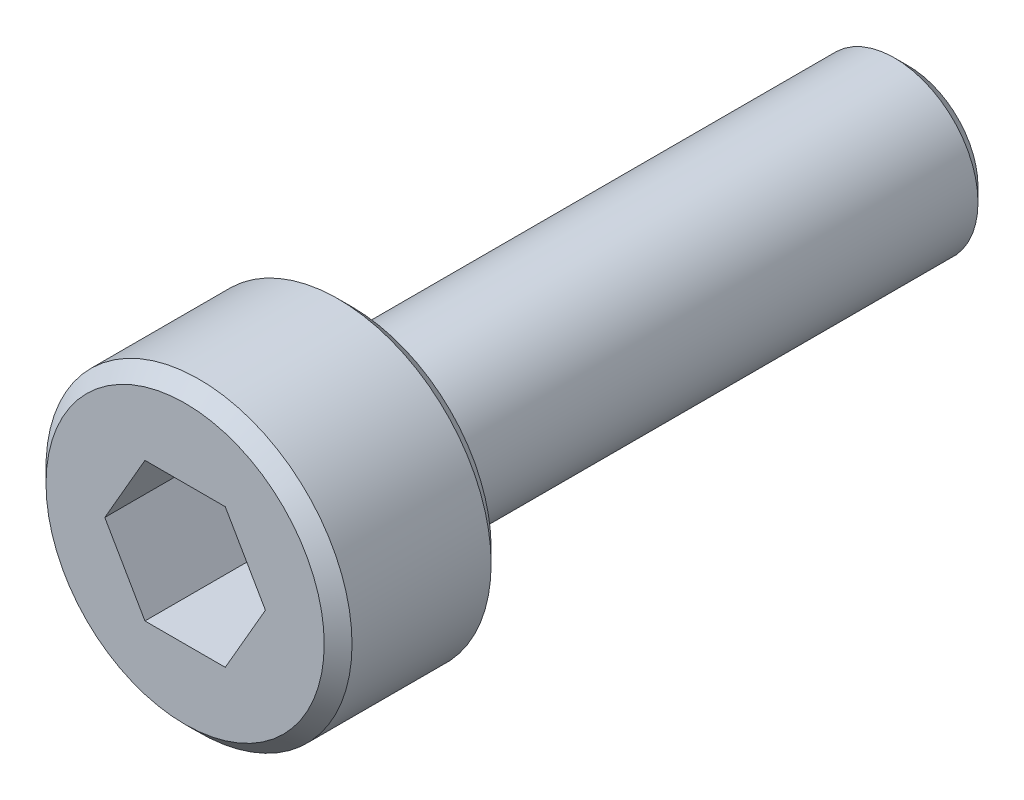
SolidWorks part; units mm, degrees
ref_plane "Front Plane" through (0, 0, 0) normal (1, 0, 0) x (0, 1, 0)
ref_plane "Top Plane" through (0, 0, 0) normal (0, 0, 1) x (0, 1, 0)
ref_plane "Right Plane" through (0, 0, 0) normal (0, 1, 0) x (-1, 0, 0)
sketch "Sketch1" plane through (0, 0, 0) normal (0, 0, 1) x (0, 1, 0)
  circle A0 centre (0, 0) radius 1.5
  dimension "D1" = 3
extrude "Boss-Extrude1" add sketch "Sketch1" along normal blind 10
sketch "Sketch2" plane through (0, 0, 10) normal (0, 0, 1) x (1, 0, 0)
  circle A0 centre (0, 0) radius 2.75
  dimension "D1" = 5.5
extrude "Boss-Extrude2" add sketch "Sketch2" along normal blind 3
chamfer "Chamfer1" distance 0.25 angle 45 3 edges at (2.75, 0, 10) (1.5, 0, 0) (2.75, 0, 13)
sketch "Sketch3" plane through (0, 0, 13) normal (0, 0, 1) x (1, 0, 0)
  line L1 (1.4434, 0) -> (0.7217, 1.25)
  line L2 (0.7217, 1.25) -> (-0.7217, 1.25)
  line L3 (-0.7217, 1.25) -> (-1.4434, 0)
  line L4 (-1.4434, 0) -> (-0.7217, -1.25)
  line L5 (-0.7217, -1.25) -> (0.7217, -1.25)
  line L6 (0.7217, -1.25) -> (1.4434, 0)
  circle A0 centre (0, 0) radius 1.25 construction
  dimension "D1" = 2.5
extrude "Cut-Extrude1" cut sketch "Sketch3" against normal blind 2
